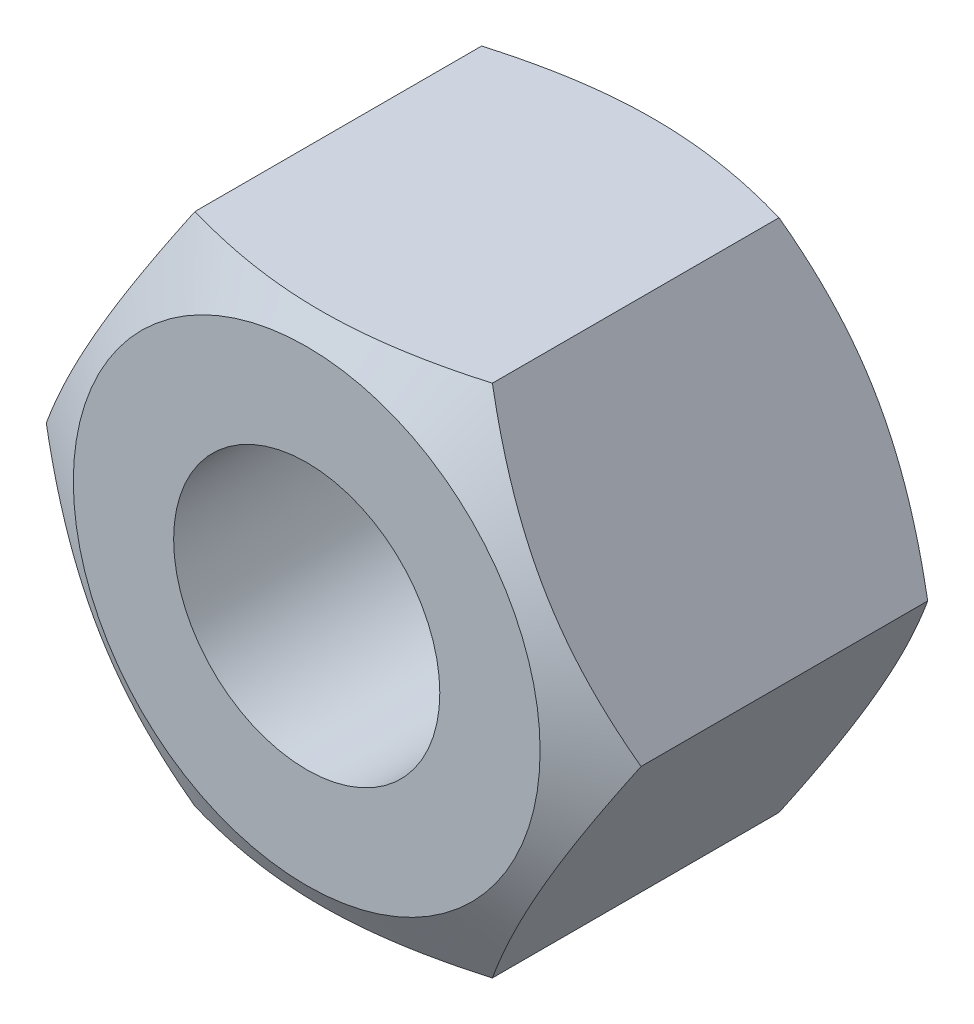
SolidWorks part; units mm, degrees
ref_plane "Front" through (0, 0, 0) normal (0, 0, 1) x (1, 0, 0)
ref_plane "Top" through (0, 0, 0) normal (0, 1, 0) x (1, 0, 0)
ref_plane "Right" through (0, 0, 0) normal (1, 0, 0) x (0, 0, -1)
sketch "Sketch1" plane through (0, 0, 0) normal (0, 0, 1) x (1, 0, 0)
  line L1 (2.3094, -4) -> (4.6188, 0)
  line L2 (4.6188, 0) -> (2.3094, 4)
  line L3 (2.3094, 4) -> (-2.3094, 4)
  line L4 (-2.3094, 4) -> (-4.6188, 0)
  line L5 (-4.6188, 0) -> (-2.3094, -4)
  line L6 (-2.3094, -4) -> (2.3094, -4)
  circle A0 centre (0, 0) radius 4 construction
  circle A1 centre (0, 0) radius 2.067
  dimension "D" = 4.134
  dimension "s" = 8
extrude "BaseNut" add sketch "Sketch1" against normal blind 5.6
sketch "Sketch2" plane through (0, 0, 0) normal (0, 1, 0) x (1, 0, 0)
  line L0 (-4.6188, 5.6) -> (-3.625, 5.6)
  line L2 (-3.625, 5.6) -> (-4.6188, 5.0262)
  line L3 (-4.6188, 5.0262) -> (-4.6188, 5.6)
  line L4 (0, 3.3759) -> (0, -9.8171) construction
  line L6 (-9.7712, 2.8) -> (9.8853, 2.8) construction
  line L7 (-4.6188, 0.5738) -> (-4.6188, 0)
  line L8 (-3.625, 0) -> (-4.6188, 0.5738)
  line L9 (-4.6188, 0) -> (-3.625, 0)
  line L10 (-4.6188, 5.6) -> (-4.6188, 0) construction
  dimension "D1" = 30
  dimension "dw" = 7.25
  dimension "D2" = 2.8
revolve "Double-Chamfer" cut sketch "Sketch2" angle 360 about L4
sketch "Sketch4" plane through (0, 0, 0) normal (0, 1, 0) x (1, 0, 0)
  line L0 (2.442, 5.6) -> (2.067, 5.3835)
  line L1 (2.067, 5.3835) -> (1.634, 5.3835)
  line L2 (1.634, 5.3835) -> (1.634, 5.8165)
  line L3 (1.634, 5.8165) -> (2.067, 5.8165)
  line L4 (2.067, 5.8165) -> (2.442, 5.6)
  line L5 (0, 0) -> (0, 109.7681) construction
  dimension "D1" = 0.433
  dimension "D2" = 4.134
revolve "Cut-Revolve10" [suppressed] cut sketch "Sketch4" angle 360 about L5
pattern_linear "LPattern10" [suppressed] count 12 spacing 0.5196 along (0, 0, -1)
equation "\"dw@Sketch2\" = \"s@Sketch1\"-0.75"
equation "\"D2@Sketch2\" = \"m@BaseNut\" / 2"
equation "\"D2@Sketch4\"=\"D@Sketch1\""
equation "\"D1@Sketch4\" =  (\"D@ThreadCosmetic1\" - \"D2@Sketch4\"  )  / 2"
equation "\"D3@LPattern10\" = \"D1@Sketch4\" * 1.2"
equation "\"D1@LPattern10\" = \"m@BaseNut\" / \"D3@LPattern10\" + 1"
